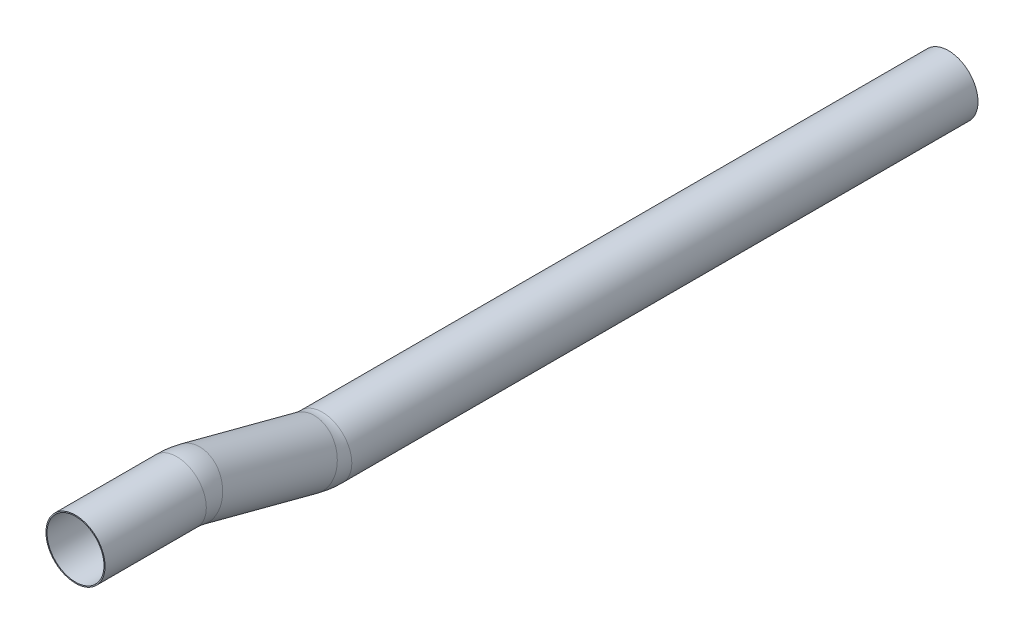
SolidWorks part; units mm, degrees
ref_plane "Front" through (0, 0, 0) normal (0, 0, 1) x (1, 0, 0)
ref_plane "Top" through (0, 0, 0) normal (0, 1, 0) x (1, 0, 0)
ref_plane "Right" through (0, 0, 0) normal (1, 0, 0) x (0, 0, -1)
sketch "Sketch1" plane through (0, 0, 0) normal (0, 0, 1) x (1, 0, 0)
  circle A0 centre (0, 0) radius 119.38
  circle A1 centre (0, 0) radius 123.825
  dimension "D1" = 238.76
  dimension "D2" = 247.65
sketch "Sketch2" plane through (0, 0, 0) normal (1, 0, 0) x (0, 0, -1)
  line L0 (0, 0) -> (424.3055, 0)
  line L1 (489.0093, -8.3795) -> (969.2018, -134.8765)
  line L2 (1033.9055, -143.256) -> (3657.6, -143.256)
  arc A0 (424.3055, 0) -> (489.0093, -8.3795) centre (424.3055, -254) cw
  arc A1 (969.2018, -134.8765) -> (1033.9055, -143.256) centre (1033.9055, 110.744) ccw
  point P7 (457.2, 0)
  dimension "D4" = 254
  dimension "D5" = 254
  dimension "D1" = 143.256
  dimension "D2" = 3657.6
  dimension "D3" = 457.2
  dimension "D6" = 609.6
sweep "Sweep1" add profiles "Sketch1" path "Sketch2"
